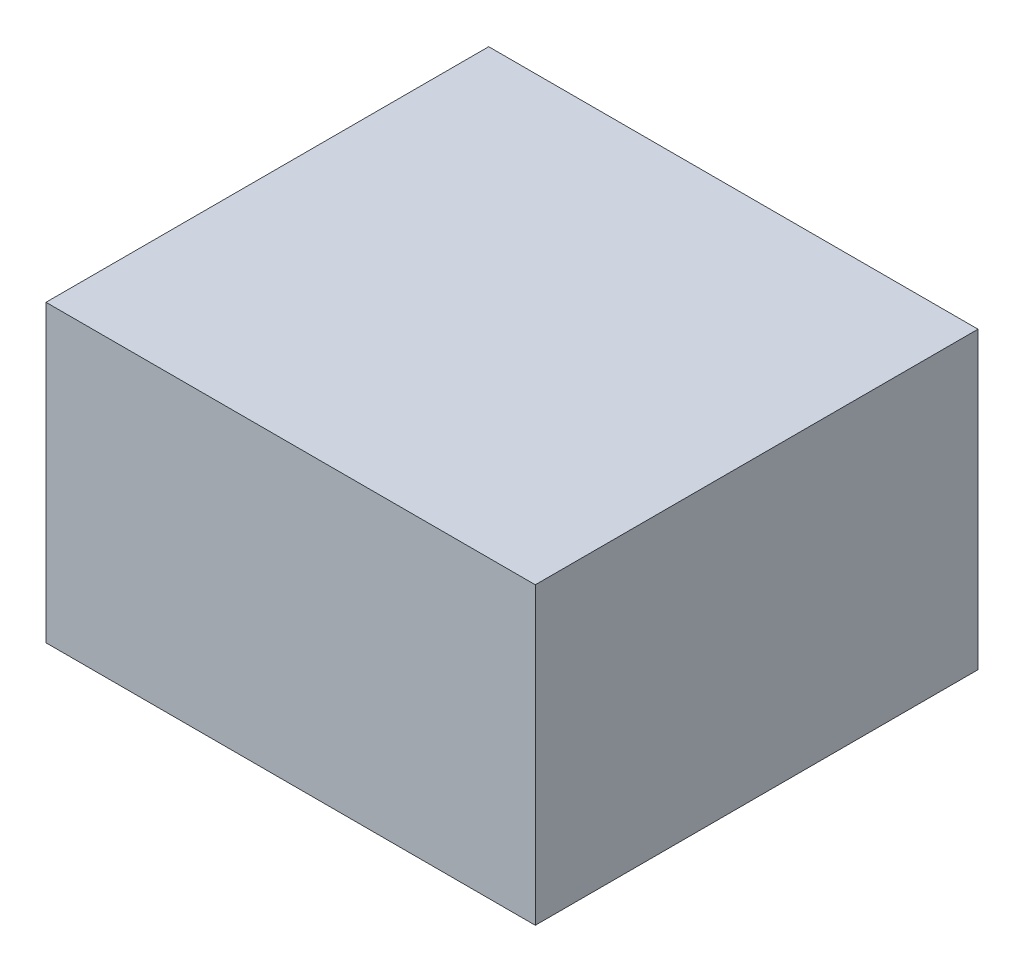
SolidWorks part; units mm, degrees
ref_plane "Front Plane" through (0, 0, 0) normal (0, 0, 1) x (1, 0, 0)
ref_plane "Top Plane" through (0, 0, 0) normal (0, 1, 0) x (1, 0, 0)
ref_plane "Right Plane" through (0, 0, 0) normal (1, 0, 0) x (0, 0, -1)
sketch "Sketch1" plane through (0, 0, 0) normal (0, 0, 1) x (1, 0, 0)
  line L0 (14.8295, 3) -> (14.8278, 0)
  line L1 (14.8278, 0) -> (19.8278, 0)
  line L2 (4.8278, 0) -> (4.8278, 13) construction
  line L4 (18.8278, 3) -> (17.8278, 3)
  line L6 (4.8278, 10.13) -> (4.8278, 13)
  line L8 (18.8278, 3) -> (19.8278, 0)
  line L12 (7.6978, 2.87) -> (14.8278, 2.87) construction
  line L13 (14.8278, 2.87) -> (14.8734, 2.87) construction
  line L14 (14.8734, 2.87) -> (14.8734, 2.87) construction
  line L15 (14.8734, 2.87) -> (14.8734, 2.87) construction
  line L16 (7.6978, 2.87) -> (7.6978, 9.7333) construction
  line L17 (4.8278, 0) -> (14.8278, 0) construction
  arc A0 (4.8278, 13) -> (17.8278, 3) centre (4.8278, -0.45) cw
  arc A1 (4.8278, 10.13) -> (14.8295, 3) centre (4.8278, -0.45) cw
  arc A2 (7.6978, 9.7333) -> (14.8734, 2.87) centre (4.8278, -0.45) cw construction
revolve "Revolve1" add sketch "Sketch1" angle 360 about L6
scale "Scale1" scale about centroid uniform scaling yes scale factor 1
other "Parting Line1"
other "Parting Surface1" parameters "D1"=11.1
sketch "Sketch2" plane through (0, 0, 0) normal (0, 1, 0) x (1, 0, 0)
  line L0 (4.8278, 0) -> (14.8295, 0) construction
  line L1 (4.8278, 0) -> (17.8278, 0) construction
  circle A0 centre (4.8278, 0) radius 20
  dimension "D1" = 40
other "Tooling Split1" parameters "D1"=10, "D2"=20, "D3"=3
move or copy body "Body-Move/Copy5" bodies to move or copy 108 copy no translate (0, -34.4321, 0)
move or copy body "Body-Move/Copy6" bodies to move or copy 103 copy no translate (0, -22.2088, 0)
delete or keep bodies "Body-Delete/Keep 1" type delete bodies bodies 114 107
sketch "Sketch3" plane through (0, -44.4321, 0) normal (0, -1, 0) x (1, 0, 0)
  line L1 (-20.1436, 21.8817) -> (29.6299, 21.8817)
  line L2 (-20.1436, 21.8817) -> (-20.1436, -23.1515)
  line L3 (-20.1436, -23.1515) -> (29.6299, -23.1515)
  line L4 (29.6299, 21.8817) -> (29.6299, -23.1515)
extrude "Boss-Extrude1" add sketch "Sketch3" along normal blind 30 separate body
delete or keep bodies "Body-Delete/Keep 2" type delete bodies bodies 113
other "Cavity1"
other "male<1>@Maleassembly1"
